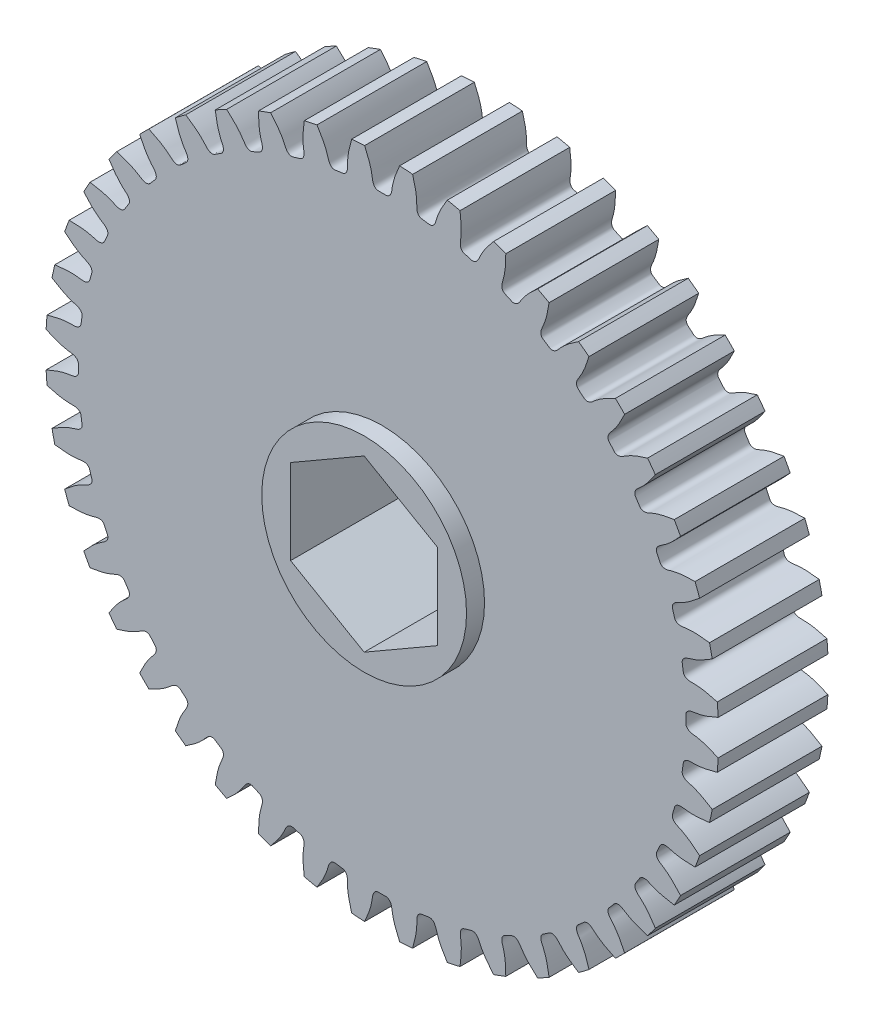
SolidWorks part; units mm, degrees
ref_plane "Front Plane" through (0, 0, 0) normal (0, 0, 1) x (1, 0, 0)
ref_plane "Top Plane" through (0, 0, 0) normal (0, 1, 0) x (1, 0, 0)
ref_plane "Right Plane" through (0, 0, 0) normal (1, 0, 0) x (0, 0, -1)
imported_body "Imported3"
sketch "Sketch1" plane through (0, 0, 4.7625) normal (0, 0, 1) x (1, 0, 0)
  circle A0 centre (0, 0) radius 8.89
extrude "Boss-Extrude1" add sketch "Sketch1" along normal blind 1.5621
sketch "Sketch2" plane through (0, 0, -4.7625) normal (0, 0, -1) x (-1, 0, 0)
  circle A0 centre (0, 0) radius 8.89
extrude "Boss-Extrude2" add sketch "Sketch2" along normal blind 1.5621
sketch "Sketch3" plane through (0, 0, -6.3246) normal (0, 0, -1) x (-1, 0, 0)
  line L0 (6.3881, 3.6882) -> (0, 7.3763)
  line L1 (0, 7.3763) -> (-6.3881, 3.6882)
  line L2 (-6.3881, 3.6882) -> (-6.3881, -3.6882)
  line L3 (-6.3881, -3.6882) -> (0, -7.3763)
  line L4 (0, -7.3763) -> (6.3881, -3.6882)
  line L5 (6.3881, -3.6882) -> (6.3881, 3.6882)
extrude "Cut-Extrude1" cut sketch "Sketch3" against normal through all
